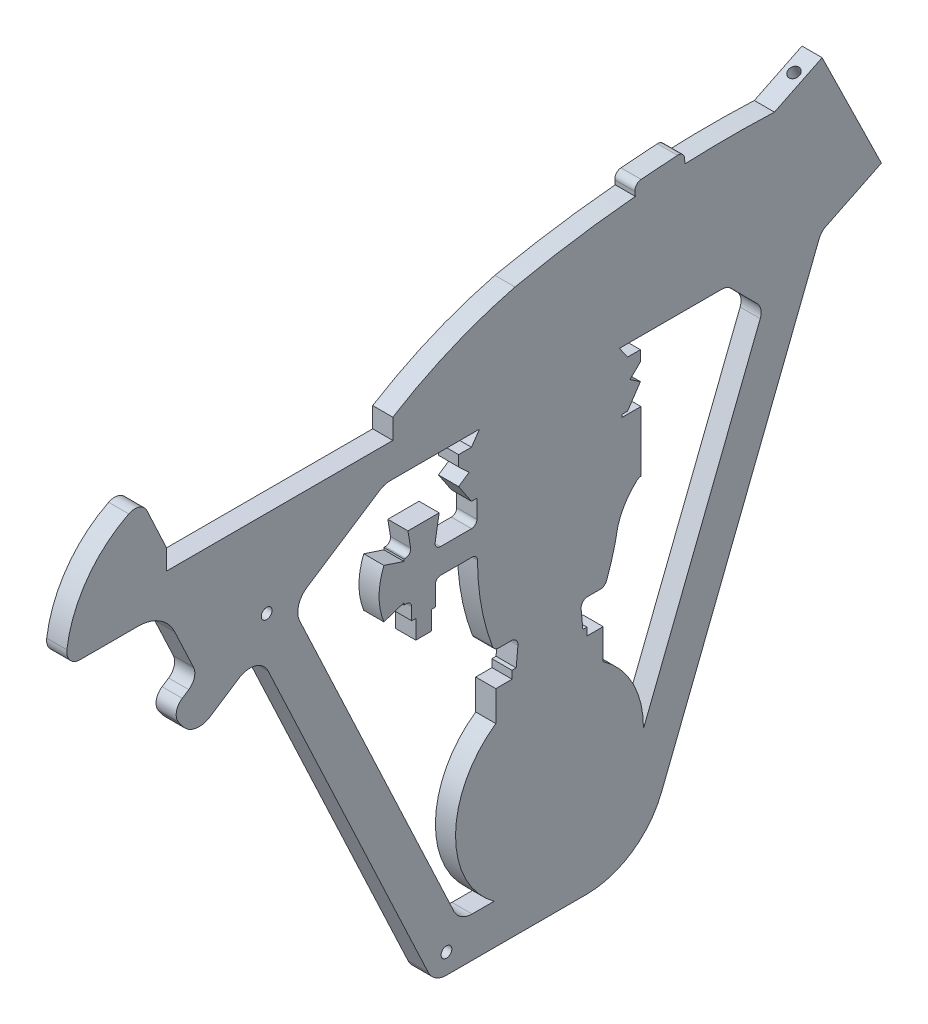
SolidWorks part; units mm, degrees
ref_plane "Alzado" through (0, 0, 0) normal (0, 0, 1) x (1, 0, 0)
ref_plane "Planta" through (0, 0, 0) normal (0, 1, 0) x (1, 0, 0)
ref_plane "Vista lateral" through (0, 0, 0) normal (1, 0, 0) x (0, 0, -1)
sketch "Croquis1" plane through (0, 0, 0) normal (1, 0, 0) x (0, 0, -1)
  line L0 (13423.4502, 5176.4506) -> (13446.3098, 5191.4506)
  line L1 (13371.4291, 5106.4337) -> (13440.034, 5151.4506)
  line L2 (13371.4291, 5106.4337) -> (13495.8185, 4841.4506)
  line L3 (13423.1289, 4925.7) -> (13476.7603, 4811.4506)
  line L4 (13476.7603, 4811.4506) -> (13509.9012, 4811.4506)
  line L5 (13332.6956, 4931.4506) -> (13414.0766, 4931.4506)
  line L6 (13280.368, 5176.4506) -> (13423.4502, 5176.4506)
  line L7 (13277.7499, 5191.4506) -> (13277.7499, 5176.4506)
  line L8 (13280.368, 5176.4506) -> (13277.7499, 5176.4506)
  line L9 (13202.7499, 5151.4506) -> (13256.6939, 5151.4506)
  line L10 (13277.7499, 5191.4506) -> (13259.0875, 5231.4723)
  line L11 (13280.3733, 5082.5668) -> (13301.5614, 5096.47)
  line L12 (13698.3807, 5148.4902) -> (13717.8112, 5128.886)
  line L13 (13763.9214, 5147.8306) -> (13646.5009, 4849.4774)
  line L14 (13720.014, 5118.1842) -> (13633.0244, 4897.153)
  line L15 (13509.9012, 4811.4506) -> (13590.6692, 4811.4506)
  line L16 (13495.8185, 4841.4506) -> (13521.7573, 4841.4506)
  line L17 (13440.034, 5151.4506) -> (13510.904, 5151.4506)
  line L18 (13615.1548, 5151.4506) -> (13691.2782, 5151.4506)
  line L19 (13283.8506, 5134.1986) -> (13301.5614, 5096.47)
  line L20 (13631.2583, 5252.3649) -> (13658.3623, 5254.3455)
  line L21 (13730.5818, 5246.1182) -> (13793.0347, 5276.7101)
  line L22 (13793.0347, 5276.7101) -> (13837.2192, 5186.5083)
  line L23 (13837.2192, 5186.5083) -> (13768.8427, 5153.1562)
  line L24 (13626.6437, 5246.9196) -> (13626.9547, 5243.5438)
  line L25 (13663.7219, 5249.5789) -> (13663.8771, 5246.0562)
  line L26 (13603.0294, 4977.9892) -> (13590.9053, 4977.9892)
  line L27 (13535.1536, 4977.9892) -> (13523.0294, 4977.9892)
  line L28 (13523.0294, 4977.9892) -> (13523.0294, 4955.4348)
  line L29 (13603.0294, 4977.9892) -> (13603.0294, 4955.4348)
  line L30 (13439.6641, 5062.6989) -> (13454.6299, 5067.639)
  line L31 (13454.6414, 5066.0779) -> (13456.4081, 5066.0779)
  line L32 (13460.4081, 5062.0779) -> (13460.4081, 5053.0415)
  line L33 (13460.4081, 5053.0415) -> (13463.4287, 5053.0415)
  line L34 (13463.4287, 5053.0415) -> (13463.4287, 5039.0446)
  line L35 (13463.4287, 5039.0446) -> (13469.1953, 5039.0446)
  line L36 (13457.5673, 5112.4895) -> (13480.8233, 5112.4895)
  line L37 (13480.8233, 5112.4895) -> (13477.8715, 5094.8867)
  line L38 (13481.8165, 5090.2252) -> (13504.9341, 5090.2252)
  line L39 (13469.1953, 5039.0446) -> (13474.962, 5039.0446)
  line L40 (13508.9341, 5094.2252) -> (13508.9341, 5107.8868)
  line L41 (13504.8879, 5107.8868) -> (13495.3189, 5122.1872)
  line L42 (13495.3189, 5122.1872) -> (13503.1358, 5127.4405)
  line L43 (13503.1358, 5127.4405) -> (13495.3189, 5134.849)
  line L44 (13495.3189, 5134.849) -> (13495.3189, 5142.7962)
  line L45 (13495.3189, 5142.7962) -> (13504.8879, 5142.7962)
  line L46 (13534.5199, 5003.137) -> (13525.2228, 5003.137)
  line L47 (13496.7791, 5142.7962) -> (13504.8879, 5142.7962)
  line L48 (13504.8879, 5142.7962) -> (13510.904, 5151.4506)
  line L49 (13504.8879, 5107.8868) -> (13508.9341, 5107.8868)
  line L50 (13587.8635, 4983.7861) -> (13590.9053, 4983.7227)
  line L51 (13590.9053, 4983.7227) -> (13590.9053, 4977.9892)
  line L52 (13539.498, 4997.6699) -> (13538.1954, 4983.7861)
  line L53 (13538.1954, 4983.7861) -> (13535.1536, 4983.7227)
  line L54 (13535.1536, 4983.7227) -> (13535.1536, 4977.9892)
  line L55 (13439.6641, 5099.1628) -> (13454.6299, 5094.2227)
  line L56 (13454.6414, 5095.7838) -> (13455.6421, 5095.7838)
  line L57 (13454.6414, 5066.0779) -> (13454.6299, 5067.639)
  line L58 (13454.6414, 5095.7838) -> (13454.6299, 5094.2227)
  line L59 (13457.5673, 5112.4895) -> (13459.587, 5100.4453)
  line L60 (13481.9826, 5071.6365) -> (13505.3722, 5071.6365)
  line L61 (13477.9826, 5067.6365) -> (13477.9826, 5053.0415)
  line L62 (13477.9826, 5053.0415) -> (13474.962, 5053.0415)
  line L63 (13474.962, 5053.0415) -> (13474.962, 5039.0446)
  line L64 (13591.539, 5003.137) -> (13600.8361, 5003.137)
  line L65 (13586.5608, 4997.6699) -> (13587.8635, 4983.7861)
  line L66 (13617.1248, 5100.9308) -> (13645.7779, 5100.9308)
  line L67 (13631.383, 5060.9308) -> (13645.7779, 5060.9308)
  line L68 (13617.1248, 5100.9308) -> (13617.1248, 5107.8868)
  line L69 (13621.171, 5107.8868) -> (13630.74, 5122.1872)
  line L70 (13630.74, 5122.1872) -> (13622.923, 5127.4405)
  line L71 (13622.923, 5127.4405) -> (13630.74, 5134.849)
  line L72 (13630.74, 5134.849) -> (13630.74, 5142.7962)
  line L73 (13630.74, 5142.7962) -> (13621.171, 5142.7962)
  line L74 (13629.2798, 5142.7962) -> (13621.171, 5142.7962)
  line L75 (13621.171, 5142.7962) -> (13615.1548, 5151.4506)
  line L76 (13621.171, 5107.8868) -> (13617.1248, 5107.8868)
  arc A0 (13423.1289, 4925.7) -> (13414.0766, 4931.4506) centre (13414.0766, 4921.4506) ccw
  arc A1 (13332.6956, 4931.4506) -> (13280.3733, 5082.5668) centre (13102.7499, 4936.4506) ccw
  arc A2 (13259.0875, 5231.4723) -> (13202.7499, 5151.4506) centre (13287.7499, 5151.4506) ccw
  arc A3 (13698.3807, 5148.4902) -> (13691.2782, 5151.4506) centre (13691.2782, 5141.4506) ccw
  arc A4 (13768.8427, 5153.1562) -> (13763.9214, 5147.8306) centre (13773.2267, 5144.1683) ccw
  arc A5 (13720.014, 5118.1842) -> (13717.8112, 5128.886) centre (13710.7087, 5121.8464) ccw
  arc A6 (13590.6692, 4811.4506) -> (13646.5009, 4849.4774) centre (13590.6692, 4871.4506) ccw
  arc A7 (13283.8506, 5134.1986) -> (13256.6939, 5151.4506) centre (13256.6939, 5121.4506) ccw
  arc A8 (13537.3157, 5229.9545) -> (13446.3098, 5191.4506) centre (13617.5259, 4913.573) ccw
  arc A9 (13730.5818, 5246.1182) -> (13663.8771, 5246.0562) centre (13697.9474, 4472.8157) ccw
  arc A10 (13626.9547, 5243.5438) -> (13537.3157, 5229.9545) centre (13697.9474, 4472.8157) ccw
  arc A11 (13631.2583, 5252.3649) -> (13626.6437, 5246.9196) centre (13631.6227, 5247.3782) ccw
  arc A12 (13663.7219, 5249.5789) -> (13658.3623, 5254.3455) centre (13658.7267, 5249.3588) ccw
  arc A13 (13523.0294, 4955.4348) -> (13521.7573, 4841.4506) centre (13563.0294, 4897.9892) ccw
  arc A14 (13633.0244, 4897.153) -> (13603.0294, 4955.4348) centre (13563.0294, 4897.9892) ccw
  arc A15 (13460.4081, 5062.0779) -> (13456.4081, 5066.0779) centre (13456.4081, 5062.0779) ccw
  arc A16 (13477.8715, 5094.8867) -> (13481.8165, 5090.2252) centre (13481.8165, 5094.2252) ccw
  arc A17 (13509.3722, 5067.6443) -> (13520.5411, 5006.3816) centre (13684.8339, 5067.9834) ccw
  arc A18 (13509.3722, 5067.6443) -> (13505.3722, 5071.6365) centre (13505.3722, 5067.6365) ccw
  arc A19 (13520.5411, 5006.3816) -> (13525.2228, 5003.137) centre (13525.2228, 5008.137) ccw
  arc A20 (13504.9341, 5090.2252) -> (13508.9341, 5094.2252) centre (13504.9341, 5094.2252) ccw
  arc A21 (13539.498, 4997.6699) -> (13534.5199, 5003.137) centre (13534.5199, 4998.137) ccw
  arc A22 (13439.6641, 5099.1628) -> (13439.6641, 5062.6989) centre (13484.5301, 5080.9308) ccw
  arc A23 (13455.6421, 5095.7838) -> (13459.587, 5100.4453) centre (13455.6421, 5099.7838) ccw
  arc A24 (13481.9826, 5071.6365) -> (13477.9826, 5067.6365) centre (13481.9826, 5067.6365) ccw
  arc A25 (13628.0348, 5059.6443) -> (13614.0373, 5037.6056) centre (13660.6623, 5023.4571) ccw
  arc A26 (13631.383, 5060.9308) -> (13628.0348, 5059.6443) centre (13631.383, 5055.9308) ccw
  arc A27 (13605.5178, 5006.3816) -> (13614.0373, 5037.6056) centre (13441.225, 5067.9834) ccw
  arc A28 (13600.8361, 5003.137) -> (13605.5178, 5006.3816) centre (13600.8361, 5008.137) ccw
  arc A29 (13591.539, 5003.137) -> (13586.5608, 4997.6699) centre (13591.539, 4998.137) ccw
  arc A30 (13650.4905, 5064.26) -> (13650.4905, 5097.6016) centre (13603.4696, 5080.9308) ccw
  arc A31 (13650.4905, 5097.6016) -> (13645.7779, 5100.9308) centre (13645.7779, 5095.9308) ccw
  arc A32 (13645.7779, 5060.9308) -> (13650.4905, 5064.26) centre (13645.7779, 5065.9308) ccw
extrude "Saliente-Extruir1" add sketch "Croquis1" along normal blind 15 contours L25 A12 L20 A11 L24 A10 A8 L0 L6 L8 L7 L10 A2 L9 A7 L19 L11 A1 L5 A0 L3 L4 L15 A6 L13 A4 L23 L22 L21 A9 A24 L60 A18 A17 A19 L46 A21 L52 L53 L54 L27 L28 A13 L16 L2 L1 L17 L48 L45
sketch "Croquis2" plane through (15, 0, 0) normal (1, 0, 0) x (0, 0, -1)
  line L0 (13423.1289, 4925.7) -> (13346.0925, 5089.8084)
  line L2 (13423.1289, 4925.7) -> (13476.7603, 4811.4506) construction
  line L3 (13332.6956, 4931.4506) -> (13414.0766, 4931.4506) construction
  line L5 (13332.6956, 4931.4506) -> (13414.0766, 4931.4506)
  line L7 (13346.0925, 5089.8084) -> (13297.8947, 5058.182)
  line L8 (13371.4291, 5106.4337) -> (13440.034, 5151.4506) construction
  arc A0 (13423.1289, 4925.7) -> (13414.0766, 4931.4506) centre (13414.0766, 4921.4506) ccw construction
  arc A1 (13332.6956, 4931.4506) -> (13280.3733, 5082.5668) centre (13102.7499, 4936.4506) ccw construction
  arc A2 (13423.1289, 4925.7) -> (13414.0766, 4931.4506) centre (13414.0766, 4921.4506) ccw
  arc A3 (13332.6956, 4931.4506) -> (13297.8947, 5058.182) centre (13102.7499, 4936.4506) ccw
extrude "Cortar-Extruir1" cut sketch "Croquis2" against normal through all
fillet "Redondeo1" radius 15 2 edges at (7.5, 5151.4506, -13440.034) (7.5, 5106.4337, -13371.4291)
fillet "Redondeo2" radius 15 2 edges at (7.5, 4841.4506, -13495.8185) (7.5, 4811.4506, -13476.7603)
fillet "Redondeo3" radius 15 1 edges at (7.5, 5089.8084, -13346.0925)
sketch "Croquis3" plane through (15, 0, 0) normal (1, 0, 0) x (0, 0, -1)
  circle A0 centre (13486.2894, 4826.4506) radius 4
  dimension "D1" = 8
extrude "Cortar-Extruir2" cut sketch "Croquis3" against normal through all
sketch "Croquis4" plane through (0, -1193.3427, -584.5477) normal (0, 0.898, 0.4399) x (1, 0, 0)
  line L0 (7.5, 14708.0153) -> (7.5, 14663.0153) construction
  line L1 (15, 14708.0153) -> (0, 14708.0153) construction
  circle A0 centre (7.5, 14663.0153) radius 4
  dimension "D1" = 8
  dimension "D2" = 45
extrude "Cortar-Extruir3" cut sketch "Croquis4" against normal through all
fillet "Redondeo4" radius 15 1 edges at (7.5, 5058.182, -13297.8947)
fillet "Redondeo5" radius 10 2 edges at (7.5, 5096.47, -13301.5614) (7.5, 5082.5668, -13280.3733)
fillet "Redondeo6" radius 10 2 edges at (7.5, 5231.4723, -13259.0875) (7.5, 5151.4506, -13202.7499)
sketch "Croquis5" plane through (0, 0, 0) normal (-1, 0, 0) x (0, 0, 1)
  line L0 (-13423.4502, 5176.4506) -> (-13446.3098, 5191.4506) construction
  line L1 (-13423.4502, 5176.4506) -> (-13446.3098, 5176.4506)
  line L2 (-13423.4502, 5176.4506) -> (-13423.4502, 5191.4506)
  line L3 (-13423.4502, 5191.4506) -> (-13446.3098, 5191.4506)
  line L4 (-13446.3098, 5176.4506) -> (-13446.3098, 5191.4506)
  dimension "D1" = 15
extrude "Cortar-Extruir4" cut sketch "Croquis5" against normal through all
sketch "Croquis6" plane through (0, 0, 0) normal (-1, 0, 0) x (0, 0, 1)
  line L0 (-13793.0347, 5276.7101) -> (-13837.2192, 5186.5083)
  line L1 (-13793.0347, 5276.7101) -> (-13766.0933, 5263.5131)
  line L2 (-13837.2192, 5186.5083) -> (-13810.2778, 5173.3113)
  line L3 (-13766.0933, 5263.5131) -> (-13810.2778, 5173.3113)
  dimension "D1" = 30
extrude "Cortar-Extruir5" cut sketch "Croquis6" against normal through all
sketch "Croquis7" plane through (0, 0, 0) normal (-1, 0, 0) x (0, 0, 1)
  line L1 (-13631.1248, 5053.4711) -> (-13673.5811, 5053.4711)
  line L2 (-13631.1248, 5053.4711) -> (-13631.1248, 5103.7066)
  line L3 (-13631.1248, 5103.7066) -> (-13673.5811, 5103.7066)
  line L4 (-13673.5811, 5053.4711) -> (-13673.5811, 5103.7066)
  line L5 (-13617.1248, 5100.9308) -> (-13617.1248, 5107.8868) construction
  dimension "D1" = 14
extrude "Cortar-Extruir6" cut sketch "Croquis7" against normal through all
sketch "Croquis8" plane through (0, 0, 0) normal (-1, 0, 0) x (0, 0, 1)
  line L0 (-13617.1248, 5100.9308) -> (-13617.1248, 5107.8868) construction
  line L1 (-13617.1248, 5105.9308) -> (-13631.1248, 5105.9308)
  line L2 (-13617.1248, 5105.9308) -> (-13617.1248, 5100.9308)
  line L3 (-13617.1248, 5100.9308) -> (-13631.1248, 5100.9308)
  line L4 (-13631.1248, 5105.9308) -> (-13631.1248, 5100.9308)
  dimension "D1" = 5
extrude "Saliente-Extruir2" add sketch "Croquis8" against normal blind 15
sketch "Croquis9" plane through (0, 0, -13631.1248) normal (0, 0, -1) x (-1, 0, 0)
  line L0 (-7.5, 5105.9308) -> (-7.5, 5083.4308) construction
  line L3 (-15, 5105.9308) -> (0, 5105.9308) construction
  circle A0 centre (-7.5, 5083.4308) radius 0.25
  dimension "D1" = 0.5
  dimension "D2" = 22.5
extrude "Cortar-Extruir7" cut sketch "Croquis9" against normal blind 0.5
sketch "Croquis10" plane through (0, 0, 0) normal (-1, 0, 0) x (0, 0, 1)
  line L0 (-13388.3204, 5135.4583) -> (-13327.1181, 5095.2988) construction
  line L1 (-13352.3221, 5111.8371) -> (-13385.3053, 5041.5741) construction
  line L3 (-13353.4412, 5074.1537) -> (-13472.711, 4820.0766) construction
  line L4 (-13382.3069, 5113.5714) -> (-13436.2867, 5148.9918) construction
  line L5 (-13382.3069, 5113.5714) -> (-13436.2867, 5148.9918) construction
  circle A0 centre (-13352.3221, 5111.8371) radius 4
  dimension "D3" = 8
  dimension "D1" = 15
  dimension "D2" = 15
extrude "Cortar-Extruir8" cut sketch "Croquis10" against normal through all
